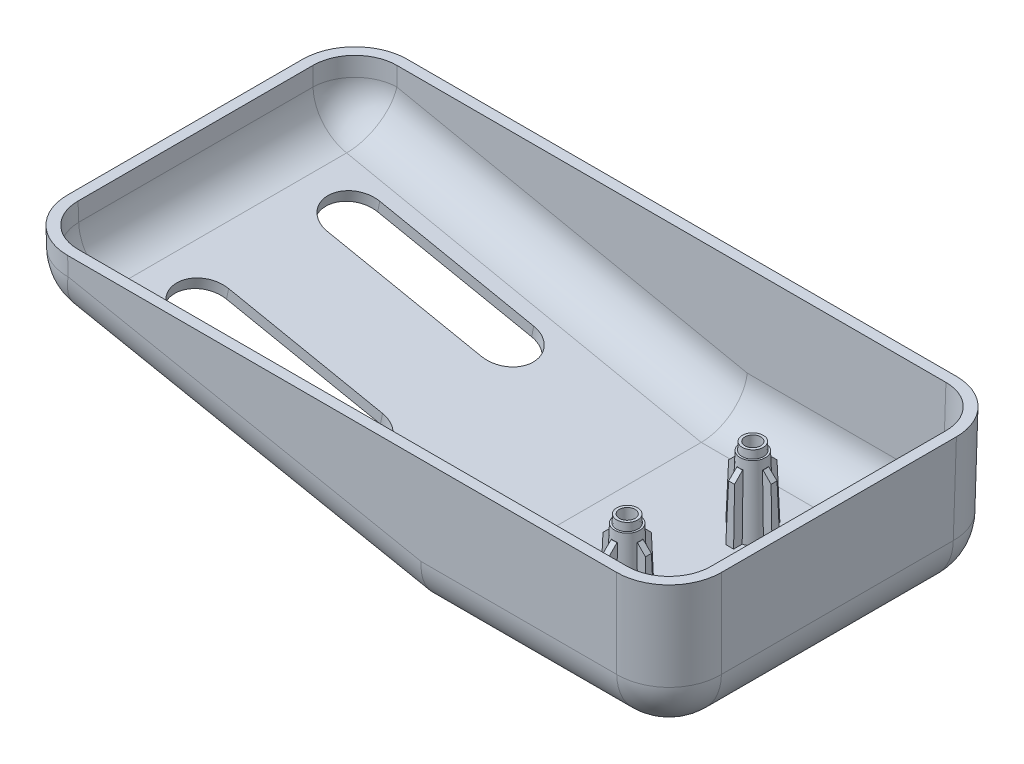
SolidWorks part; units mm, degrees
ref_plane "Front Plane" through (0, 0, 0) normal (0, 0, 1) x (1, 0, 0)
ref_plane "Top Plane" through (0, 0, 0) normal (0, 1, 0) x (1, 0, 0)
ref_plane "Right Plane" through (0, 0, 0) normal (1, 0, 0) x (0, 0, -1)
sketch "Sketch1" plane through (0, 0, 0) normal (0, 0, 1) x (1, 0, 0)
  line L0 (0, 0) -> (46, 0)
  line L1 (46, 0) -> (46, 25)
  line L2 (46, 25) -> (-74, 25)
  line L3 (-74, 25) -> (-74, 15)
  line L4 (-74, 15) -> (0, 0)
  dimension "D1" = 25
  dimension "D2" = 46
  dimension "D3" = 120
  dimension "D4" = 10
extrude "Boss-Extrude1" add sketch "Sketch1" along normal mid plane 60
draft "Draft1" type of draft neutral plane draft angle 1 faces to draft 4 parameters "D1"=1
fillet "Fillet1" radius 8 10 edges at (46.2182, 12.5, 30.2182) (23, 0, 30) (-37.1314, 7.5266, 30.1314) (-74.3496, 20.0266, 30.3496) (-74.2628, 15.0533, 0) (-74.3496, 20.0266, -30.3496) (-37.1314, 7.5266, -30.1314) (23, 0, -30) (46, 0, 0) (46.2182, 12.5, -30.2182)
shell "Shell1" thickness 2
sketch "Sketch2" plane through (0, 0, 0) normal (0.1987, 0.9801, 0) x (0.9801, -0.1987, 0)
  line L0 (-59.8797, -14.4367) -> (-29.8797, -14.4367) construction
  line L1 (-59.8797, -9.4367) -> (-29.8797, -9.4367)
  line L2 (-59.8797, -19.4367) -> (-29.8797, -19.4367)
  line L3 (-79.8797, -22.4382) -> (-79.8797, 22.4382) construction
  line L4 (32.7055, -32.4367) -> (-70.0805, -32.4367) construction
  line L5 (-14.85, 0) -> (14.85, 0) construction
  line L6 (-59.8797, 14.4367) -> (-29.8797, 14.4367) construction
  line L7 (-59.8797, 9.4367) -> (-29.8797, 9.4367)
  line L8 (-59.8797, 19.4367) -> (-29.8797, 19.4367)
  arc A0 (-59.8797, -9.4367) -> (-59.8797, -19.4367) centre (-59.8797, -14.4367) ccw
  arc A1 (-29.8797, -19.4367) -> (-29.8797, -9.4367) centre (-29.8797, -14.4367) ccw
  arc A2 (-59.8797, 9.4367) -> (-59.8797, 19.4367) centre (-59.8797, 14.4367) cw
  arc A3 (-29.8797, 19.4367) -> (-29.8797, 9.4367) centre (-29.8797, 14.4367) cw
  point P2 (-44.8797, -14.4367)
  point P15 (-44.8797, 14.4367)
  dimension "D1" = 10
  dimension "D2" = 30
  dimension "D3" = 20
  dimension "D4" = 18
extrude "Cut-Extrude1" cut sketch "Sketch2" against normal blind 60
sketch3d "3DSketch2"
  point P0 (19.996, 0, -11.9973)
  dimension "D1" = 28
  dimension "D2" = 20
other "Mounting Boss2" parameters "BossHeight"=14, "BossDiam"=4.8, "StepHeight"=1.5, "StepDia"=4, "HoleDiam"=3, "CBoreDiam"=4, "CBoreDepth"=2, "D8"=0, "D9"=0, "D10"=0, "Clearance"=0.254, "FinLength"=4, "FinWidth"=1.5, "FinHeight"=12, "ChamferDist"=1.5, "BossDraft"=2, "HoleDraft"=1, "StepDraft"=0, "D19"=0, "FinDraft"=1, "ChamferAngle"=45
mirror "Mirror1" about plane through (0, 0, 0) normal (0, 0, 1) of "Mounting Boss2"
